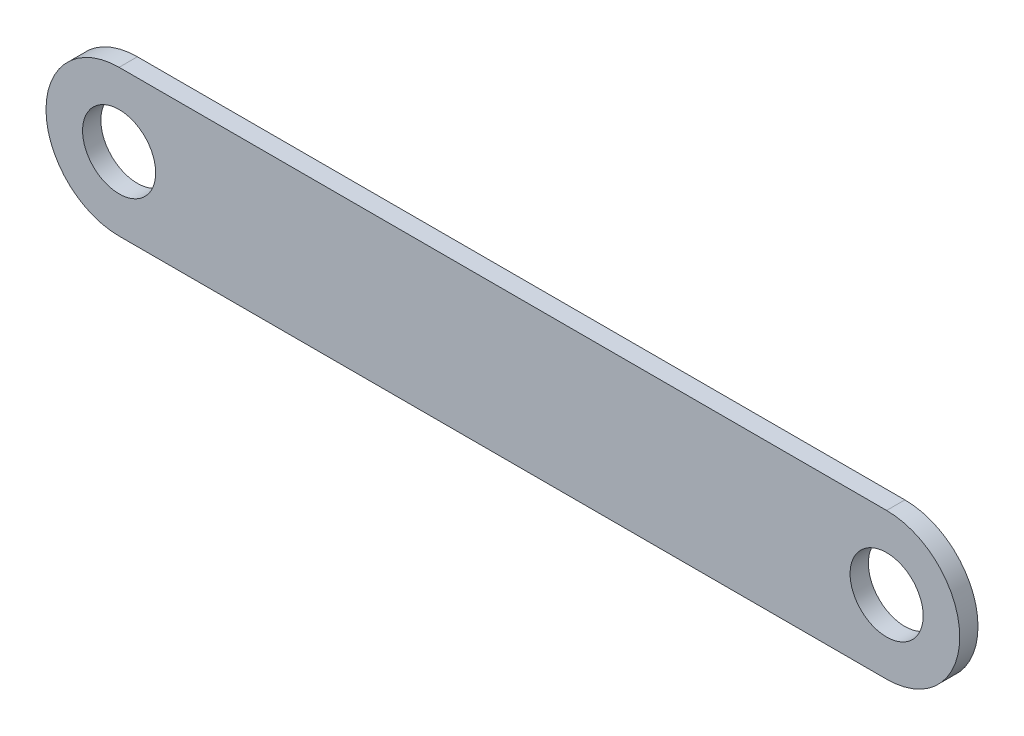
SolidWorks part; units mm, degrees
ref_plane "Front Plane" through (0, 0, 0) normal (0, 0, 1) x (1, 0, 0)
ref_plane "Top Plane" through (0, 0, 0) normal (0, 1, 0) x (1, 0, 0)
ref_plane "Right Plane" through (0, 0, 0) normal (1, 0, 0) x (0, 0, -1)
sketch "Sketch1" plane through (0, 0, 0) normal (0, 0, 1) x (1, 0, 0)
  line L0 (105, 20) -> (-105, 20)
  line L1 (-105, -20) -> (105, -20)
  line L2 (-105, 0) -> (105, 0) construction
  arc A0 (105, -20) -> (105, 20) centre (105, 0) ccw
  arc A1 (-105, 20) -> (-105, -20) centre (-105, 0) ccw
  point P6 (0, 0)
  dimension "D2" = 20
  dimension "D1" = 210
extrude "Boss-Extrude1" add sketch "Sketch1" along normal blind 5
sketch "Sketch2" plane through (0, 0, 5) normal (0, 0, 1) x (1, 0, 0)
  circle A0 centre (-105, 0) radius 10
  circle A1 centre (105, 0) radius 10
  dimension "D1" = 20
extrude "Cut-Extrude1" cut sketch "Sketch2" against normal through all
